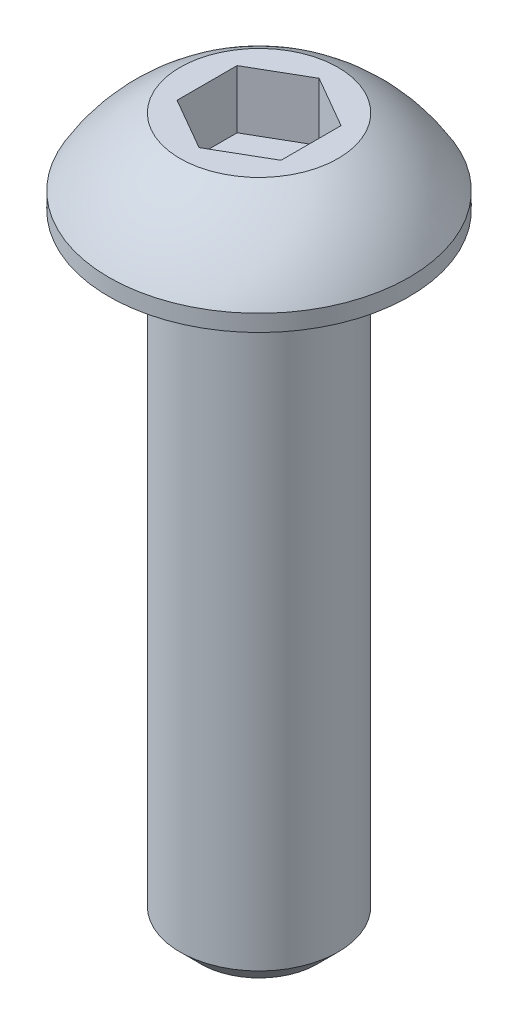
SolidWorks part; units mm, degrees
ref_plane "Front" through (0, 0, 0) normal (0, 0, 1) x (1, 0, 0)
ref_plane "Top" through (0, 0, 0) normal (0, 1, 0) x (1, 0, 0)
ref_plane "Right" through (0, 0, 0) normal (1, 0, 0) x (0, 0, -1)
sketch "Sketch1" plane through (0, 0, 0) normal (0, 0, 1) x (1, 0, 0)
  line L0 (0, 0) -> (4.5847, 0)
  line L1 (4.5847, 0) -> (4.5847, 0.508)
  line L2 (2.413, 2.5654) -> (0, 2.5654)
  line L3 (0, 2.5654) -> (0, 0)
  line L4 (0, 0) -> (0, 100) construction
  arc A0 (4.5847, 0.508) -> (2.413, 2.5654) centre (0, -2.1565) ccw
revolve "Base-Revolve" add sketch "Sketch1" angle 360 about L4
sketch "Sketch2" plane through (0, 0, 0) normal (0, 0, 1) x (1, 0, 0)
  line L0 (0, 0) -> (0, 100) construction
  line L1 (0, -19.05) -> (1.7831, -19.05)
  line L2 (1.7831, -19.05) -> (2.413, -18.4201)
  line L3 (2.413, -18.4201) -> (2.413, 0)
  line L4 (2.413, 0) -> (0, 0)
  line L5 (0, 0) -> (0, -19.05)
  dimension "D1" = 19.05
revolve "Boss-Revolve1" add sketch "Sketch2" angle 360 about L0
ref_plane "Plane4" through (0, 2.5654, 0) normal (0, 1, 0) x (-1, 0, 0)
sketch "Sketch3" plane through (0, 2.5654, 0) normal (0, 1, 0) x (-1, 0, 0)
  line L0 (1.5875, 0.9165) -> (0, 1.8331)
  line L1 (0, 1.8331) -> (-1.5875, 0.9165)
  line L2 (-1.5875, 0.9165) -> (-1.5875, -0.9165)
  line L3 (-1.5875, -0.9165) -> (0, -1.8331)
  line L4 (0, -1.8331) -> (1.5875, -0.9165)
  line L5 (1.5875, -0.9165) -> (1.5875, 0.9165)
extrude "Cut-Extrude1" cut sketch "Sketch3" against normal blind 1.778
